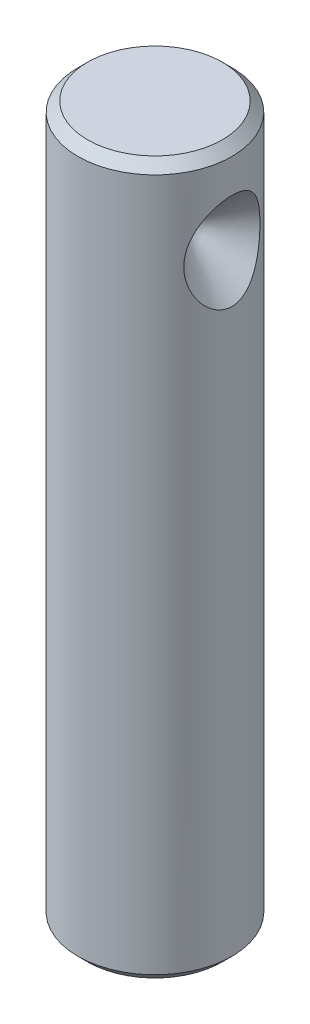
SolidWorks part; units mm, degrees
ref_plane "Plan de face" through (0, 0, 0) normal (0, 0, 1) x (1, 0, 0)
ref_plane "Plan de dessus" through (0, 0, 0) normal (0, 1, 0) x (1, 0, 0)
ref_plane "Plan de droite" through (0, 0, 0) normal (1, 0, 0) x (0, 0, -1)
sketch "Esquisse1" plane through (0, 0, 0) normal (0, 1, 0) x (1, 0, 0)
  circle A0 centre (0, 0) radius 4
  dimension "D1" = 8
extrude "Extrusion1" add sketch "Esquisse1" along normal blind 37
chamfer "Chanfrein1" distance 0.5 angle 45 2 edges at (0, 0, 4) (0, 37, 4)
sketch "Esquisse3" plane through (0, 0, 0) normal (0, 0, 1) x (1, 0, 0)
  line L0 (6.7518, 32.25) -> (0.2196, 32.25) construction
  line L1 (3.5, 37) -> (-3.5, 37) construction
  line L2 (1.5, 32.25) -> (5.3022, 36.0522)
  line L3 (5.3022, 36.0522) -> (5.3022, 32.25)
  line L4 (4, 0.5) -> (4, 36.5) construction
  line L5 (1.5, 32.25) -> (5.3022, 32.25)
  dimension "D1" = 4.75
  dimension "D2" = 2.5
  dimension "D3" = 45
revolve "Enlèvement de matière-Révolution7" cut sketch "Esquisse3" angle 360 about L0
